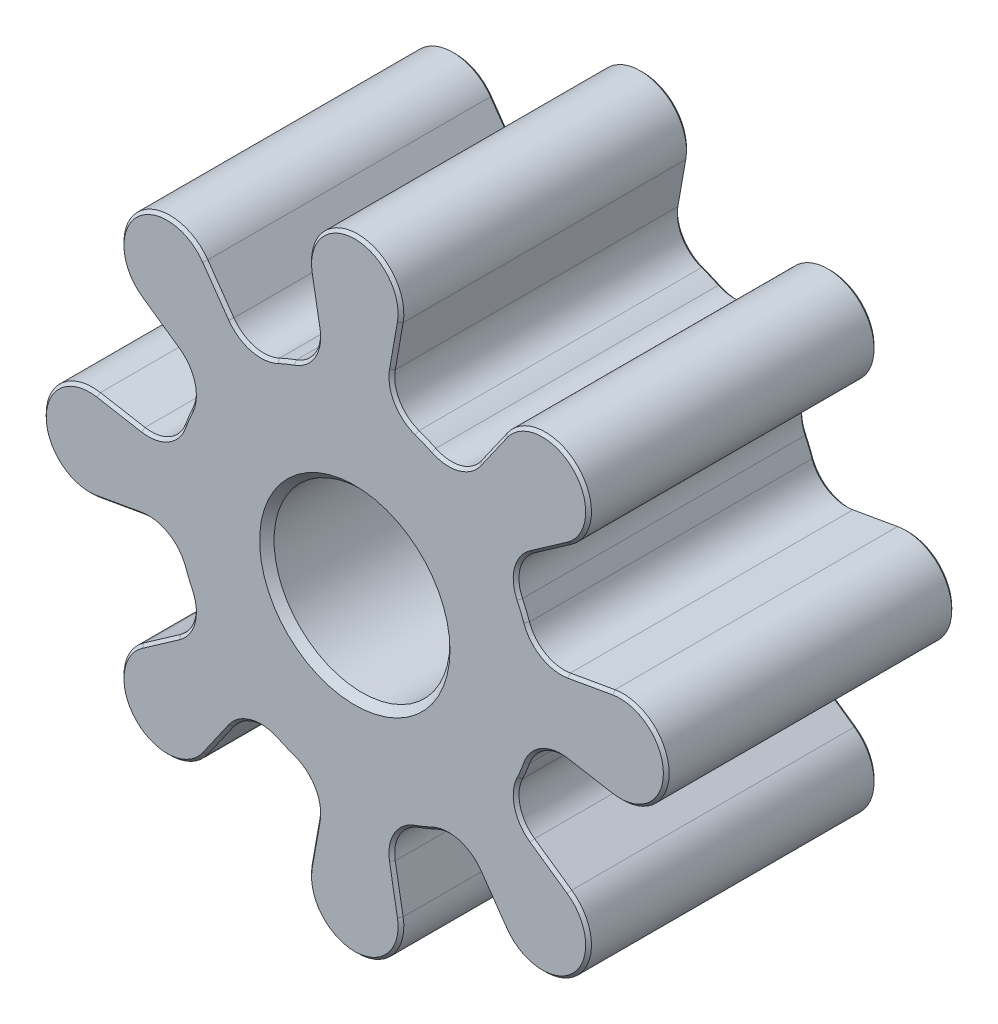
SolidWorks part; units mm, degrees
ref_plane "Спереди" through (0, 0, 0) normal (0, 0, 1) x (1, 0, 0)
ref_plane "Сверху" through (0, 0, 0) normal (0, 1, 0) x (1, 0, 0)
ref_plane "Справа" through (0, 0, 0) normal (1, 0, 0) x (0, 0, -1)
sketch "Эскиз1" plane through (0, 0, 0) normal (0, 0, 1) x (1, 0, 0)
  line L0 (-1.3023, 7.374) -> (-1.5756, 8.9217)
  line L1 (1.3023, 7.374) -> (1.5756, 8.9217)
  line L2 (4.2933, 6.135) -> (5.1945, 7.4228)
  line L3 (6.135, 4.2933) -> (7.4228, 5.1945)
  line L4 (7.374, 1.3023) -> (8.9217, 1.5756)
  line L5 (7.374, -1.3023) -> (8.9217, -1.5756)
  line L6 (6.135, -4.2933) -> (7.4228, -5.1945)
  line L7 (4.2933, -6.135) -> (5.1945, -7.4228)
  line L8 (1.3023, -7.374) -> (1.5756, -8.9217)
  line L9 (-1.3023, -7.374) -> (-1.5756, -8.9217)
  line L10 (-4.2933, -6.135) -> (-5.1945, -7.4228)
  line L11 (-6.135, -4.2933) -> (-7.4228, -5.1945)
  line L12 (-7.374, -1.3023) -> (-8.9217, -1.5756)
  line L13 (-7.374, 1.3023) -> (-8.9217, 1.5756)
  line L14 (-6.135, 4.2933) -> (-7.4228, 5.1945)
  line L15 (-4.2933, 6.135) -> (-5.1945, 7.4228)
  line L16 (0, 18.3827) -> (0, -18.3427) construction
  line L32 (-0.1559, 0.8828) -> (-1.6833, 9.5315)
  line L33 (0.1587, 0.8984) -> (1.673, 9.473)
  line L34 (5.564, -0.5673) -> (9.4119, 7.3275)
  line L35 (5.8276, -0.7396) -> (12.0928, 5.3074)
  line L36 (9.3392, -5.1025) -> (17.0926, -0.9772)
  line L37 (9.4512, -5.3968) -> (18.0741, -4.1873)
  line L38 (9.7276, -10.9905) -> (18.425, -12.2105)
  line L39 (9.6452, -11.2945) -> (17.3322, -15.3844)
  line L40 (6.581, -15.9824) -> (12.9002, -22.0815)
  line L41 (6.3356, -16.1798) -> (10.1506, -24.007)
  line L42 (1.1011, -18.1713) -> (2.6285, -26.82)
  line L43 (0.7866, -18.1869) -> (-0.7278, -26.7615)
  line L44 (-4.8824, -16.5489) -> (-11.1476, -22.5959)
  line L45 (-8.3939, -12.186) -> (-16.1473, -16.3113)
  line L46 (-8.5059, -11.8917) -> (-17.1289, -13.1012)
  line L47 (-8.7824, -6.298) -> (-17.4798, -5.078)
  line L48 (-8.7, -5.994) -> (-16.387, -1.9041)
  line L49 (-5.6357, -1.3061) -> (-11.955, 4.793)
  line L50 (-5.3904, -1.1087) -> (-9.2053, 6.7185)
  line L51 (9.3392, -5.1025) -> (17.0926, -0.9772)
  line L52 (9.4512, -5.3968) -> (18.0741, -4.1873)
  line L53 (9.7276, -10.9905) -> (18.425, -12.2105)
  line L54 (9.6452, -11.2945) -> (17.3322, -15.3844)
  line L55 (6.581, -15.9824) -> (12.9002, -22.0815)
  line L56 (6.3356, -16.1798) -> (10.1506, -24.007)
  line L57 (1.1011, -18.1713) -> (2.6285, -26.82)
  line L58 (0.7866, -18.1869) -> (-0.7278, -26.7615)
  line L59 (-4.6188, -16.7212) -> (-8.4667, -24.616)
  line L60 (5.564, -0.5673) -> (9.4119, 7.3275)
  line L61 (5.8276, -0.7396) -> (12.0928, 5.3074)
  circle A0 centre (0, 0) radius 9.2 construction
  arc A1 (1.5756, 8.9217) -> (-1.5756, 8.9217) centre (0, 9.2) ccw
  circle A2 centre (0, 0) radius 3.05
  arc A3 (-2.7089, -5.7156) -> (-2.126, -5.957) centre (0, 0) ccw
  arc A4 (7.4228, 5.1945) -> (5.1945, 7.4228) centre (6.5054, 6.5054) ccw
  arc A5 (8.9217, -1.5756) -> (8.9217, 1.5756) centre (9.2, 0) ccw
  arc A6 (5.1945, -7.4228) -> (7.4228, -5.1945) centre (6.5054, -6.5054) ccw
  arc A7 (-1.5756, -8.9217) -> (1.5756, -8.9217) centre (0, -9.2) ccw
  arc A8 (-7.4228, -5.1945) -> (-5.1945, -7.4228) centre (-6.5054, -6.5054) ccw
  arc A9 (-8.9217, 1.5756) -> (-8.9217, -1.5756) centre (-9.2, 0) ccw
  arc A10 (-5.1945, 7.4228) -> (-7.4228, 5.1945) centre (-6.5054, 6.5054) ccw
  arc A11 (-5.957, -2.126) -> (-5.7156, -2.7089) centre (0, 0) ccw
  arc A12 (-5.7156, 2.7089) -> (-5.957, 2.126) centre (0, 0) ccw
  arc A13 (-2.126, 5.957) -> (-2.7089, 5.7156) centre (0, 0) ccw
  arc A14 (2.7089, 5.7156) -> (2.126, 5.957) centre (0, 0) ccw
  arc A15 (5.957, 2.126) -> (5.7156, 2.7089) centre (0, 0) ccw
  arc A16 (5.7156, -2.7089) -> (5.957, -2.126) centre (0, 0) ccw
  arc A17 (2.126, -5.957) -> (2.7089, -5.7156) centre (0, 0) ccw
  arc A18 (7.374, -1.3023) -> (5.957, -2.126) centre (7.1531, -2.5529) ccw
  arc A19 (6.135, -4.2933) -> (5.7156, -2.7089) centre (6.8632, -3.2528) cw
  arc A20 (4.2933, -6.135) -> (2.7089, -5.7156) centre (3.2528, -6.8632) ccw
  arc A21 (1.3023, -7.374) -> (2.126, -5.957) centre (2.5529, -7.1531) cw
  arc A22 (-1.3023, -7.374) -> (-2.126, -5.957) centre (-2.5529, -7.1531) ccw
  arc A23 (-4.2933, -6.135) -> (-2.7089, -5.7156) centre (-3.2528, -6.8632) cw
  arc A24 (-6.135, -4.2933) -> (-5.7156, -2.7089) centre (-6.8632, -3.2528) ccw
  arc A25 (-7.374, -1.3023) -> (-5.957, -2.126) centre (-7.1531, -2.5529) cw
  arc A26 (-7.374, 1.3023) -> (-5.957, 2.126) centre (-7.1531, 2.5529) ccw
  arc A27 (-6.135, 4.2933) -> (-5.7156, 2.7089) centre (-6.8632, 3.2528) cw
  arc A28 (7.374, 1.3023) -> (5.957, 2.126) centre (7.1531, 2.5529) cw
  arc A29 (6.135, 4.2933) -> (5.7156, 2.7089) centre (6.8632, 3.2528) ccw
  arc A30 (4.2933, 6.135) -> (2.7089, 5.7156) centre (3.2528, 6.8632) cw
  arc A31 (1.3023, 7.374) -> (2.126, 5.957) centre (2.5529, 7.1531) ccw
  arc A32 (-1.3023, 7.374) -> (-2.126, 5.957) centre (-2.5529, 7.1531) cw
  arc A33 (-4.2933, 6.135) -> (-2.7089, 5.7156) centre (-3.2528, 6.8632) ccw
  arc A66 (1.5756, 8.9217) -> (-1.5756, 8.9217) centre (0, 9.2) ccw
  arc A67 (11.69, 4.9186) -> (9.1406, 6.7709) centre (10.5788, 6.0698) ccw
  arc A68 (17.5197, -4.2651) -> (16.5459, -1.2681) centre (17.2975, -2.6806) ccw
  arc A69 (16.838, -15.1215) -> (17.8118, -12.1245) centre (17.5895, -13.7089) ccw
  arc A70 (9.9053, -23.5038) -> (12.4547, -21.6515) centre (11.3436, -22.8028) ccw
  arc A71 (-0.6304, -26.2102) -> (2.5208, -26.2102) centre (0.9452, -26.4885) ccw
  arc A72 (-10.7448, -22.2071) -> (-8.1954, -24.0594) centre (-9.6336, -23.3583) ccw
  arc A73 (-16.5745, -13.0234) -> (-15.6007, -16.0204) centre (-16.3522, -14.6079) ccw
  arc A74 (-15.8928, -2.167) -> (-16.8666, -5.164) centre (-16.6443, -3.5796) ccw
  arc A75 (-8.9601, 6.2153) -> (-11.5095, 4.363) centre (-10.3983, 5.5143) ccw
  arc A76 (17.5197, -4.2651) -> (16.5459, -1.2681) centre (17.2975, -2.6806) ccw
  arc A77 (16.838, -15.1215) -> (17.8118, -12.1245) centre (17.5895, -13.7089) ccw
  arc A78 (9.9053, -23.5038) -> (12.4547, -21.6515) centre (11.3436, -22.8028) ccw
  arc A79 (-0.6304, -26.2102) -> (2.5208, -26.2102) centre (0.9452, -26.4885) ccw
  arc A80 (11.69, 4.9186) -> (9.1406, 6.7709) centre (10.5788, 6.0698) ccw
  point P48 (5.1821, -3.6265)
  point P53 (1.1, -6.2286)
  point P62 (-6.2286, -1.1)
  point P67 (-5.1821, 3.6265)
  point P70 (6.2286, 1.1)
  point P75 (3.6265, 5.1821)
  point P80 (-1.1, 6.2286)
  dimension "D1" = 18.4
  dimension "D2" = 3.2
  dimension "D3" = 6.1
  dimension "D5" = 12.65
  dimension "D6" = 8
  dimension "D7" = 1.27
  dimension "D4" = 10
extrude "Бобышка-Вытянуть1" add sketch "Эскиз1" along normal blind 10
chamfer "Фаска1" distance 0.25 angle 45 2 edges at (3.05, 0, 0) (3.05, 0, 10)
chamfer "Фаска2" distance 0.1 angle 45 96 edges at (7.6368, -7.6368, 0) (6.7789, -4.7439, 0) (4.7439, -6.7789, 0) (5.6355, -3.5778, 0) (3.5778, -5.6355, 0) (5.8435, -2.4205, 0) (2.4205, -5.8435, 0) (6.5148, -1.455, 0) (1.455, -6.5148, 0) (8.1478, -1.4389, 0) (1.4389, -8.1478, 0) (10.8, 0, 0) (0, -10.8, 0) (8.1478, 1.4389, 0) (-1.4389, -8.1478, 0) (6.5148, 1.455, 0) (-1.455, -6.5148, 0) (5.8435, 2.4205, 0) (-2.4205, -5.8435, 0) (5.6355, 3.5778, 0) (-3.5778, -5.6355, 0) (6.7789, 4.7439, 0) (-4.7439, -6.7789, 0) (7.6368, 7.6368, 0) (-7.6368, -7.6368, 0) (4.7439, 6.7789, 0) (-6.7789, -4.7439, 0) (3.5778, 5.6355, 0) (-5.6355, -3.5778, 0) (2.4205, 5.8435, 0) (-5.8435, -2.4205, 0) (1.455, 6.5148, 0) (-6.5148, -1.455, 0) (1.4389, 8.1478, 0) (-8.1478, -1.4389, 0) (0, 10.8, 0) (-10.8, 0, 0) (-1.4389, 8.1478, 0) (-8.1478, 1.4389, 0) (-1.455, 6.5148, 0) (-6.5148, 1.455, 0) (-2.4205, 5.8435, 0) (-5.8435, 2.4205, 0) (-3.5778, 5.6355, 0) (-5.6355, 3.5778, 0) (-4.7439, 6.7789, 0) (-6.7789, 4.7439, 0) (-7.6368, 7.6368, 0) (8.1478, -1.4389, 10) (10.8, 0, 10) (6.5148, -1.455, 10) (8.1478, 1.4389, 10) (5.8435, -2.4205, 10) (6.5148, 1.455, 10) (5.6355, -3.5778, 10) (5.8435, 2.4205, 10) (6.7789, -4.7439, 10) (5.6355, 3.5778, 10) (7.6368, -7.6368, 10) (6.7789, 4.7439, 10) (4.7439, -6.7789, 10) (7.6368, 7.6368, 10) (3.5778, -5.6355, 10) (4.7439, 6.7789, 10) (2.4205, -5.8435, 10) (3.5778, 5.6355, 10) (1.455, -6.5148, 10) (2.4205, 5.8435, 10) (1.4389, -8.1478, 10) (1.455, 6.5148, 10) (0, -10.8, 10) (1.4389, 8.1478, 10) (-1.4389, -8.1478, 10) (0, 10.8, 10) (-1.455, -6.5148, 10) (-1.4389, 8.1478, 10) (-2.4205, -5.8435, 10) (-1.455, 6.5148, 10) (-3.5778, -5.6355, 10) (-2.4205, 5.8435, 10) (-4.7439, -6.7789, 10) (-3.5778, 5.6355, 10) (-7.6368, -7.6368, 10) (-4.7439, 6.7789, 10) (-6.7789, -4.7439, 10) (-7.6368, 7.6368, 10) (-5.6355, -3.5778, 10) (-6.7789, 4.7439, 10) (-5.8435, -2.4205, 10) (-5.6355, 3.5778, 10) (-6.5148, -1.455, 10) (-5.8435, 2.4205, 10) (-8.1478, -1.4389, 10) (-6.5148, 1.455, 10) (-10.8, 0, 10) (-8.1478, 1.4389, 10)
